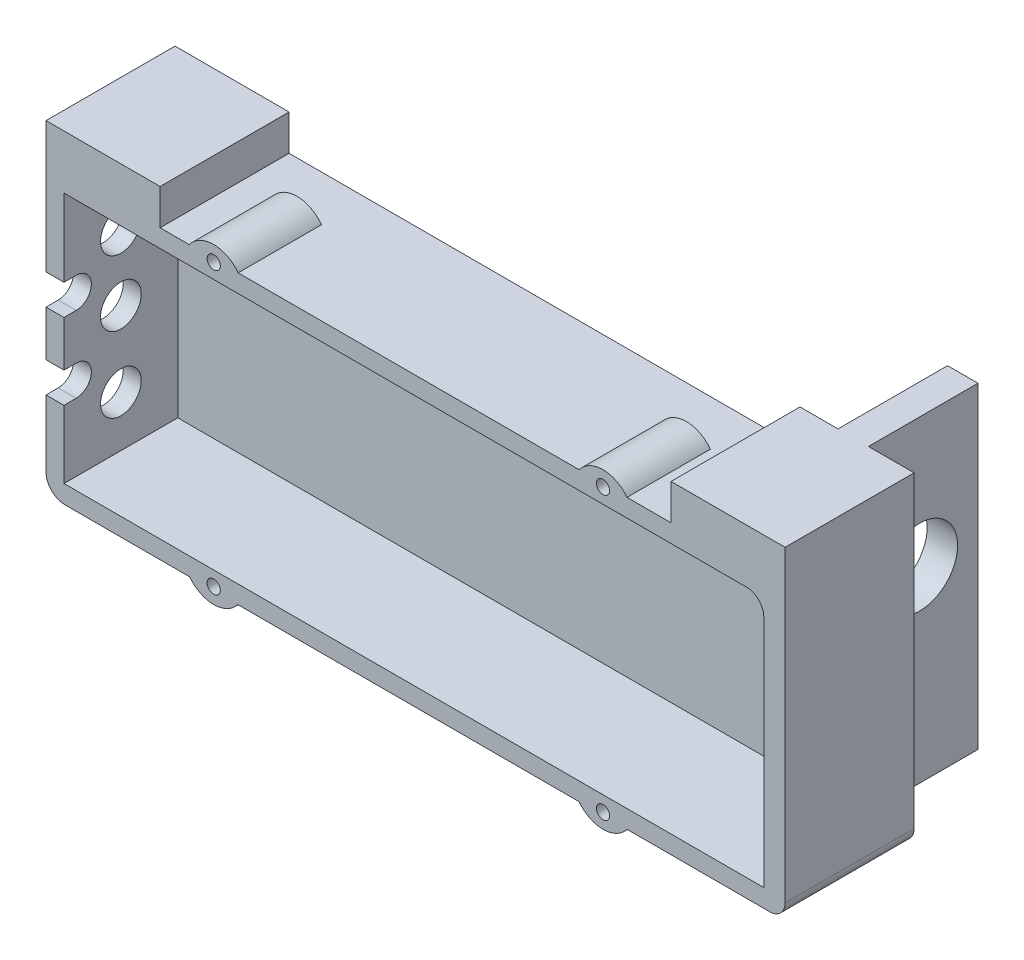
SolidWorks part; units mm, degrees
ref_plane "Front Plane" through (0, 0, 0) normal (0, 0, 1) x (1, 0, 0)
ref_plane "Top Plane" through (0, 0, 0) normal (0, 1, 0) x (1, 0, 0)
ref_plane "Right Plane" through (0, 0, 0) normal (1, 0, 0) x (0, 0, -1)
imported_body "Imported4"
sketch "Sketch10" plane through (0, 0, 0) normal (0, 0, -1) x (-1, 0, 0)
  line L0 (3, 45) -> (-125, 45)
  line L1 (3, 45) -> (3, -3)
  line L2 (3, -3) -> (-125, -3)
  line L3 (-125, 45) -> (-125, -3)
  line L4 (-137.7, 57.7) -> (15.7, 57.7)
  line L5 (-137.7, 57.7) -> (-137.7, -15.7)
  line L6 (-137.7, -15.7) -> (15.7, -15.7)
  line L7 (15.7, 57.7) -> (15.7, -15.7)
extrude "Cut-Extrude6" cut sketch "Sketch10" against normal blind 5.08
sketch "Sketch11" plane through (0, 0, 0) normal (0, 0, -1) x (-1, 0, 0)
  line L0 (-125, 45) -> (3, 45)
  line L1 (-125, 45) -> (-125, -3)
  line L2 (-125, -3) -> (3, -3)
  line L3 (3, 45) -> (3, -3)
extrude "Boss-Extrude3" add sketch "Sketch11" along normal blind 2.54
fillet "Fillet5" radius 3.175 28 edges at (124.1213, -2.1213, 19) (-2.1213, -2.1213, 19) (-2.1213, 44.1213, 19) (124.1213, 44.1213, 19) (125, 45, -1.27) (125, -3, -1.27) (-3, -3, -1.27) (-3, 45, -1.27)
sketch "Sketch12" plane through (125, 0, 0) normal (1, 0, 0) x (0, 0, -1)
  line L0 (-19, 25) -> (-19, 17) construction
  line L1 (-19, 33.675) -> (-12.65, 33.675)
  line L2 (-19, 33.675) -> (-19, 8.325)
  line L3 (-19, 8.325) -> (-12.65, 8.325)
  line L4 (-12.65, 33.675) -> (-12.65, 8.325)
  line L5 (-19, 30.5) -> (-16.25, 30.5) construction
  line L6 (-16.25, 11.5) -> (-19, 11.5) construction
  dimension "D1" = 6.35
  dimension "D2" = 3.175
  dimension "D3" = 3.175
extrude "Boss-Extrude4" add sketch "Sketch12" against normal up to surface (3 mm away)
sketch "Sketch13" plane through (-3, 0, 0) normal (-1, 0, 0) x (0, 0, 1)
  line L0 (9.5, 31.95) -> (9.5, 8.45) construction
  line L1 (9.5, 20.2) -> (19, 20.2) construction
  line L2 (19, 41.825) -> (19, 0.175) construction
  line L3 (16.968, 29.09) -> (19, 29.09)
  line L4 (16.968, 24.01) -> (19, 24.01)
  line L5 (19, 29.09) -> (19, 24.01)
  line L6 (19, 11.31) -> (19, 16.39)
  line L7 (16.968, 16.39) -> (19, 16.39)
  line L8 (16.968, 11.31) -> (19, 11.31)
  arc A0 (16.968, 29.09) -> (16.968, 24.01) centre (16.968, 26.55) ccw
  arc A1 (16.968, 11.31) -> (16.968, 16.39) centre (16.968, 13.85) cw
  dimension "D2" = 5.08
  dimension "D1" = 6.35
  dimension "D3" = 2.032
extrude "Cut-Extrude7" cut sketch "Sketch13" against normal blind 7.62
sketch "Sketch14" plane through (0, 0, 19) normal (0, 0, 1) x (1, 0, 0)
  line L0 (0, 42) -> (0, 29.09) construction
  line L1 (116.84, 46.3033) -> (129.54, 46.3033)
  line L2 (116.84, 46.3033) -> (116.84, -4.4967)
  line L3 (116.84, -4.4967) -> (129.54, -4.4967)
  line L4 (129.54, 46.3033) -> (129.54, -4.4967)
  line L5 (0, 0) -> (0, 42) construction
  line L6 (121.825, 45) -> (94, 45) construction
  point P4 (0, 35.545)
  dimension "D1" = 116.84
  dimension "D2" = 12.7
  dimension "D3" = 50.8
  dimension "D4" = 1.3032
extrude "Cut-Extrude8" cut sketch "Sketch14" against normal through all
sketch "Sketch15" plane through (116.84, 0, 0) normal (1, 0, 0) x (0, 0, -1)
  line L1 (-19, 45) -> (2.54, 45)
  line L2 (-19, 45) -> (-19, -3)
  line L3 (-19, -3) -> (2.54, -3)
  line L4 (2.54, 45) -> (2.54, -3)
extrude "Boss-Extrude5" add sketch "Sketch15" along normal blind 3.556
fillet "Fillet6" radius 2.54 2 edges at (120.396, -3, 8.23) (120.396, 45, 8.23)
sketch "Sketch16" plane through (0, 0, -2.54) normal (0, 0, -1) x (-1, 0, 0)
  line L0 (-117.856, -3) -> (-0.175, -3) construction
  line L1 (-107.696, 10.716) -> (-69.596, 10.716)
  line L2 (-107.696, 10.716) -> (-107.696, -1.984)
  line L3 (-107.696, -1.984) -> (-69.596, -1.984)
  line L4 (-69.596, 10.716) -> (-69.596, -1.984)
  line L5 (-120.396, -0.46) -> (-120.396, 42.46) construction
  dimension "D1" = 13.716
  dimension "D2" = 12.7
  dimension "D3" = 38.1
  dimension "D4" = 12.7
extrude "Boss-Extrude6" add sketch "Sketch16" along normal up to surface (18.288 mm away)
sketch "Sketch18" plane through (107.696, 0, 0) normal (1, 0, 0) x (0, 0, -1)
  line L1 (20.828, -1.984) -> (2.54, -1.984)
  line L2 (20.828, -1.984) -> (20.828, 42.46)
  line L3 (20.828, 42.46) -> (2.54, 42.46)
  line L4 (2.54, -1.984) -> (2.54, 42.46)
  circle A0 centre (11.0686, 29.258) radius 6.35
  dimension "D1" = 12.7
  dimension "D2" = 31.242
  dimension "D3" = 8.5286
extrude "Boss-Extrude7" add sketch "Sketch18" along normal blind 5.08
sketch "Sketch20" plane through (120.396, 0, 0) normal (1, 0, 0) x (0, 0, -1)
  line L0 (-19, 42.46) -> (-19, -0.46) construction
  line L1 (-19, 38.275) -> (2.54, 38.275)
  line L2 (-19, 38.275) -> (-19, 50.975)
  line L3 (-19, 50.975) -> (2.54, 50.975)
  line L4 (2.54, 38.275) -> (2.54, 50.975)
  line L5 (2.54, -0.46) -> (2.54, 42.46) construction
  line L6 (-19, -0.46) -> (2.54, -0.46) construction
  dimension "D1" = 12.7
  dimension "D2" = 38.735
extrude "Boss-Extrude9" add sketch "Sketch20" against normal blind 19.05
sketch "Sketch21" plane through (0, 0, -2.54) normal (0, 0, -1) x (-1, 0, 0)
  line L0 (-117.856, -3) -> (-0.175, -3) construction
  line L1 (-48.2281, 28.242) -> (-1.4921, 28.242)
  line L2 (-48.2281, 28.242) -> (-48.2281, -3)
  line L3 (-48.2281, -3) -> (-51.4031, -3)
  line L4 (-1.4921, 28.242) -> (-1.4921, -3)
  line L5 (-47.9741, 27.988) -> (-47.9741, 20.114) construction
  line L6 (-1.7461, 27.988) -> (-47.9741, 27.988) construction
  line L7 (-1.7461, 20.114) -> (-1.7461, 27.988) construction
  line L8 (-51.4031, -3) -> (-51.4031, 31.417)
  line L9 (-51.4031, 31.417) -> (3, 31.417)
  line L10 (3, 0.175) -> (3, 41.825) construction
  line L11 (3, 31.417) -> (3, 0.175)
  arc A0 (3, 0.175) -> (-1.4921, -3) centre (-0.5577, 0.4432) cw
  dimension "D4" = 3.5678
  dimension "D1" = 0.254
  dimension "D2" = 0.254
  dimension "D3" = 0.254
  dimension "D5" = 3.175
  dimension "D6" = 3.175
extrude "Boss-Extrude10" add sketch "Sketch21" along normal blind 12.7
sketch "Sketch22" plane through (0, 0, 19) normal (0, 0, 1) x (1, 0, 0)
  line L0 (101.346, 42) -> (113.9967, 42)
  line L1 (116.84, 38.275) -> (116.84, 39.1567)
  line L2 (101.346, 42) -> (101.346, 38.275)
  line L3 (101.346, 38.275) -> (116.84, 38.275)
  arc A0 (116.84, 39.1567) -> (113.9967, 42) centre (113.9967, 39.1567) ccw
  dimension "D1" = 2.8433
extrude "Cut-Extrude9" cut sketch "Sketch22" against normal up to surface (19 mm away)
sketch "Sketch24" plane through (0, 0, 19) normal (0, 0, 1) x (1, 0, 0)
  line L0 (16.05, 43.73) -> (16.05, 50.975)
  line L1 (16.05, 50.975) -> (-3, 50.975)
  line L2 (-3, 50.975) -> (-3, 41.19)
  line L3 (-3, 41.19) -> (-0.46, 41.19)
  line L4 (-0.46, 41.19) -> (-0.46, 43.73)
  line L5 (-0.46, 43.73) -> (16.05, 43.73)
  line L6 (101.346, 50.975) -> (120.396, 50.975) construction
  line L7 (-3, 41.825) -> (-3, 29.09) construction
  line L8 (20.9217, 45) -> (0.175, 45) construction
  dimension "D1" = 19.05
  dimension "D2" = 1.27
  dimension "D3" = 3.81
  dimension "D4" = 2.54
extrude "Boss-Extrude11" add sketch "Sketch24" against normal up to surface (21.54 mm away)
sketch "Sketch26" plane through (0, 45, 0) normal (0, 1, 0) x (1, 0, 0)
  line L1 (107.696, 2.54) -> (112.776, 2.54)
  line L2 (107.696, 2.54) -> (107.696, 20.828)
  line L3 (107.696, 20.828) -> (112.776, 20.828)
  line L4 (112.776, 2.54) -> (112.776, 20.828)
extrude "Boss-Extrude13" add sketch "Sketch26" against normal blind 2.54
sketch "Sketch27" plane through (112.776, 0, 0) normal (1, 0, 0) x (0, 0, -1)
  line L0 (20.828, -1.984) -> (20.828, 45) construction
  line L1 (20.828, 45) -> (2.54, 45)
  line L2 (20.828, 45) -> (20.828, 50.975)
  line L3 (20.828, 50.975) -> (2.54, 50.975)
  line L4 (2.54, 45) -> (2.54, 50.975)
  line L5 (2.54, 50.975) -> (-19, 50.975) construction
  line L6 (2.54, 45) -> (2.54, -1.984) construction
  line L7 (2.54, 45) -> (20.828, 45) construction
extrude "Boss-Extrude14" add sketch "Sketch27" against normal up to surface (5.08 mm away)
sketch "Sketch29" plane through (0, -3, 0) normal (0, -1, 0) x (1, 0, 0)
  line L0 (86, 19) -> (63, 19) construction
  line L1 (51, 19) -> (63.4283, 19)
  line L2 (51, 19) -> (51, 7.57)
  line L3 (51, 7.57) -> (63.4283, 7.57)
  line L4 (63.4283, 19) -> (63.4283, 7.57)
  line L5 (51, 11) -> (51, 19) construction
  dimension "D1" = 11.43
  dimension "D2" = 12.4283
extrude "Boss-Extrude16" add sketch "Sketch29" against normal up to surface (3 mm away)
